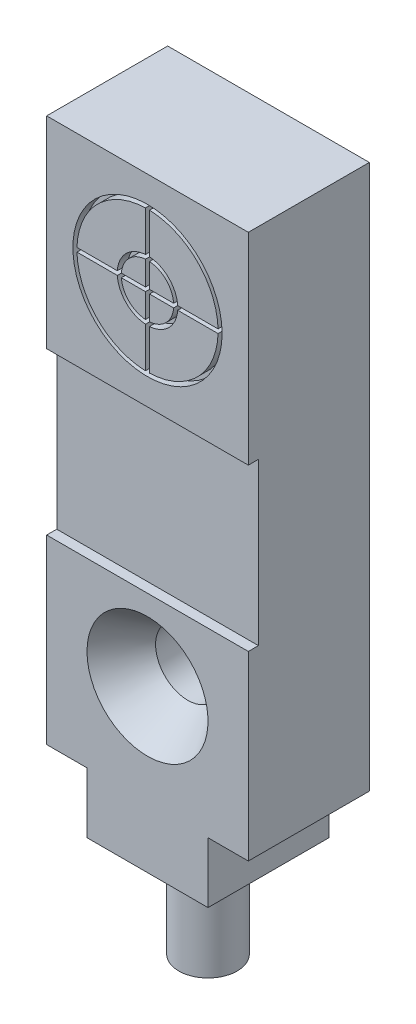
SolidWorks part; units mm, degrees
ref_plane "前视基准面" through (0, 0, 0) normal (0, 0, 1) x (1, 0, 0)
ref_plane "上视基准面" through (0, 0, 0) normal (0, 1, 0) x (1, 0, 0)
ref_plane "右视基准面" through (0, 0, 0) normal (1, 0, 0) x (0, 0, -1)
sketch "草图1" plane through (0, 0, 0) normal (0, 0, 1) x (1, 0, 0)
  line L0 (0, 0) -> (0, 27)
  line L1 (0, 27) -> (10, 27)
  line L2 (10, 27) -> (10, 0)
  line L3 (10, 0) -> (0, 0)
extrude "凸台-拉伸1" add sketch "草图1" along normal blind 6
sketch "草图2" plane through (0, 0, 6) normal (0, 0, 1) x (1, 0, 0)
  line L1 (10, 0) -> (10, 27) construction
  line L2 (10, 9) -> (0, 9)
  line L3 (0, 27) -> (0, 0) construction
  line L4 (0, 9) -> (0, 17)
  line L5 (0, 17) -> (10, 17)
  line L6 (10, 17) -> (10, 9)
extrude "切除-拉伸1" cut sketch "草图2" against normal blind 0.5
sketch "草图3" plane through (0, 0, 6) normal (0, 0, 1) x (1, 0, 0)
  circle A0 centre (5, 5) radius 1.6
extrude "切除-拉伸2" cut sketch "草图3" against normal blind 6
chamfer "倒角1" distance 1.4 distance2 2 1 edges at (6.6, 5, 6)
sketch "草图5" plane through (0, 0, 6) normal (0, 0, 1) x (1, 0, 0)
  circle A0 centre (5, 22) radius 3.5
  circle A1 centre (5, 22) radius 3.7
extrude "切除-拉伸3" cut sketch "草图5" against normal blind 0.5
sketch "草图6" plane through (0, 0, 6) normal (0, 0, 1) x (1, 0, 0)
  circle A0 centre (5, 22) radius 1.5
  circle A1 centre (5, 22) radius 1.3
extrude "切除-拉伸4" cut sketch "草图6" against normal blind 0.5
sketch "草图7" plane through (0, 0, 6) normal (0, 0, 1) x (1, 0, 0)
  line L1 (5, 18.5) -> (5, 25.5)
  line L3 (8.5, 22) -> (1.5, 22)
  circle A0 centre (5, 22) radius 3.5 construction
  circle A1 centre (5, 22) radius 3.5 construction
extrude "切除-拉伸-薄壁1" cut sketch "草图7" against normal blind 0.5 thin
sketch "草图8" plane through (0, 0, 0) normal (0, -1, 0) x (1, 0, 0)
  line L1 (0, 6) -> (10, 6) construction
  line L2 (8, 6) -> (8, 0)
  line L3 (0, 0) -> (10, 0) construction
  line L4 (8, 0) -> (2, 0)
  line L5 (2, 0) -> (2, 6)
  line L6 (2, 6) -> (8, 6)
extrude "凸台-拉伸2" add sketch "草图8" along normal blind 3
sketch "草图9" plane through (0, -3, 0) normal (0, -1, 0) x (1, 0, 0)
  circle A0 centre (5, 3) radius 1.45
extrude "凸台-拉伸3" add sketch "草图9" along normal blind 5
